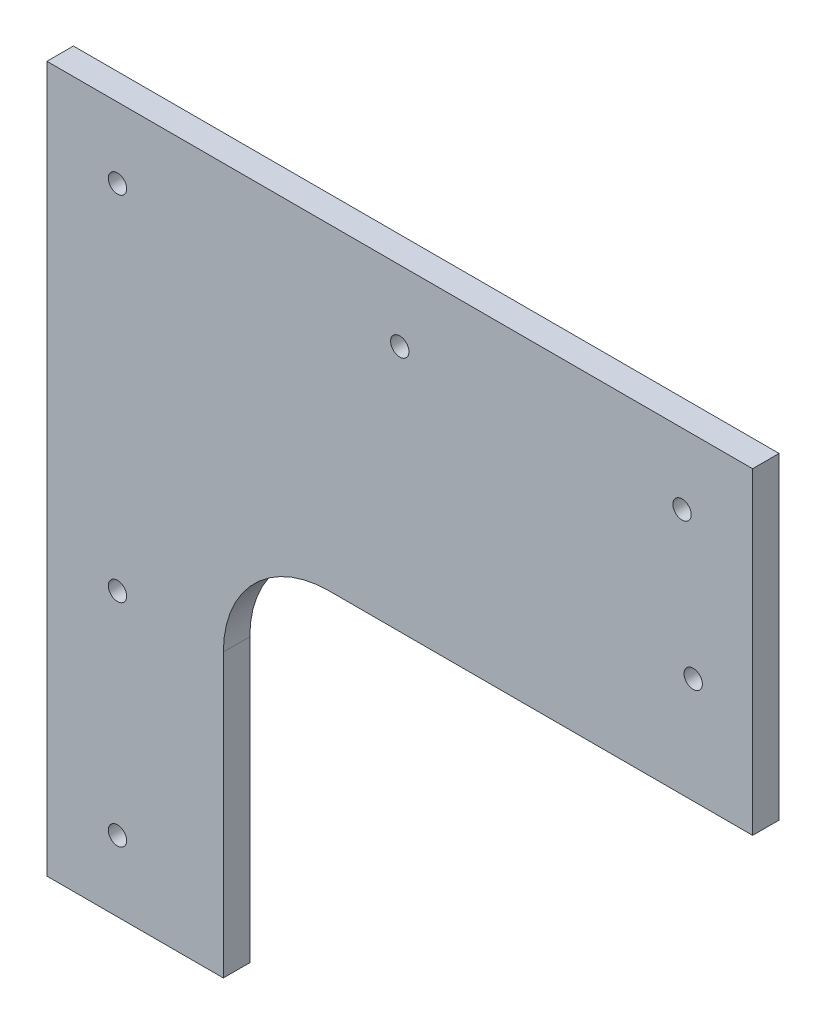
SolidWorks part; units mm, degrees
ref_plane "Front Plane" through (0, 0, 0) normal (0, 0, 1) x (1, 0, 0)
ref_plane "Top Plane" through (0, 0, 0) normal (0, 1, 0) x (1, 0, 0)
ref_plane "Right Plane" through (0, 0, 0) normal (1, 0, 0) x (0, 0, -1)
sketch "Sketch1" plane through (0, 0, 0) normal (0, 0, 1) x (1, 0, 0)
  line L0 (0, 0) -> (254, 0)
  line L1 (254, 0) -> (254, -114.3)
  line L2 (254, -114.3) -> (63.5, -114.3)
  line L3 (63.5, -114.3) -> (63.5, -254)
  line L4 (63.5, -254) -> (0, -254)
  line L5 (0, -254) -> (0, 0)
  dimension "D1" = 254
  dimension "D2" = 254
  dimension "D3" = 114.3
  dimension "D4" = 63.5
extrude "shape" add sketch "Sketch1" along normal blind 9.525
fillet "Fillet1" radius 38.1 1 edges at (63.5, -114.3, 4.7625)
sketch "Sketch2" plane through (0, 0, 9.525) normal (0, 0, 1) x (1, 0, 0)
  line L0 (254, 0) -> (0, 0) construction
  line L1 (0, 0) -> (0, -254) construction
  circle A0 centre (25.4, -228.6) radius 3.302
  circle A1 centre (25.4, -152.4) radius 3.302
  circle A2 centre (25.4, -25.4) radius 3.302
  circle A3 centre (127, -25.4) radius 3.302
  circle A4 centre (228.6, -25.4) radius 3.302
  circle A5 centre (232.6132, -76.2) radius 3.302
  dimension "D1" = 6.604
  dimension "D2" = 25.4
  dimension "D5" = 25.4
  dimension "D3" = 152.4
  dimension "D4" = 228.6
  dimension "D6" = 127
  dimension "D7" = 228.6
  dimension "D8" = 76.2
extrude "Extrude2" cut sketch "Sketch2" against normal through all
